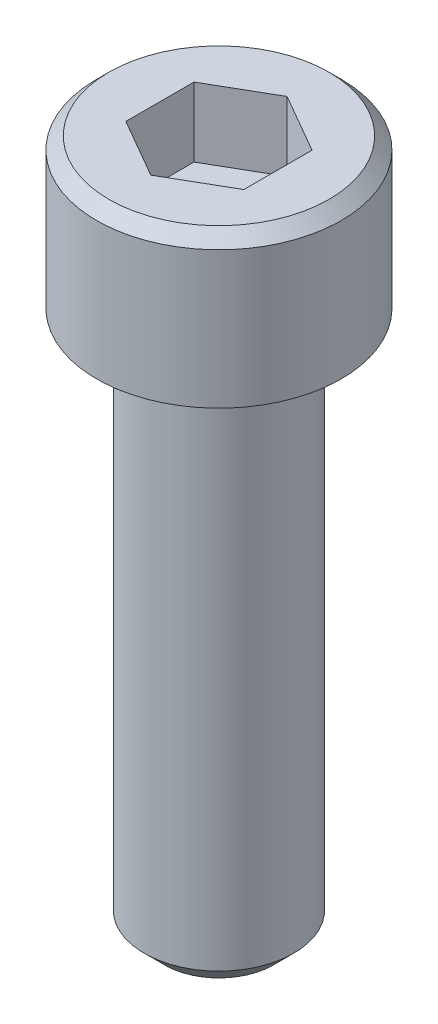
SolidWorks part; units mm, degrees
ref_plane "Front" through (0, 0, 0) normal (0, 0, 1) x (1, 0, 0)
ref_plane "Top" through (0, 0, 0) normal (0, 1, 0) x (1, 0, 0)
ref_plane "Right" through (0, 0, 0) normal (1, 0, 0) x (0, 0, -1)
sketch "Sketch1" plane through (0, 0, 0) normal (0, 0, 1) x (1, 0, 0)
  line L0 (0, 0) -> (2.8702, 0)
  line L1 (2.8702, 0) -> (2.8702, 3.2182)
  line L2 (2.8702, 3.2182) -> (2.5832, 3.5052)
  line L3 (2.5832, 3.5052) -> (0, 3.5052)
  line L4 (0, 3.5052) -> (0, 0)
  line L5 (0, 0) -> (0, 100) construction
revolve "Base-Revolve" add sketch "Sketch1" angle 360 about L5
sketch "Sketch2" plane through (0, 0, 0) normal (0, 0, 1) x (1, 0, 0)
  line L0 (0, 0) -> (0, 100) construction
  line L1 (0, -12.7) -> (1.2802, -12.7)
  line L2 (1.2802, -12.7) -> (1.7526, -12.2276)
  line L3 (1.7526, -12.2276) -> (1.7526, 0)
  line L4 (1.7526, 0) -> (0, 0)
  line L5 (0, 0) -> (0, -12.7)
revolve "Boss-Revolve1" add sketch "Sketch2" angle 360 about L0
ref_plane "Plane4" through (0, 3.5052, 0) normal (0, 1, 0) x (-1, 0, 0)
sketch "Sketch3" plane through (0, 3.5052, 0) normal (0, 1, 0) x (-1, 0, 0)
  line L0 (1.3843, 0.7992) -> (0, 1.5985)
  line L1 (0, 1.5985) -> (-1.3843, 0.7992)
  line L2 (-1.3843, 0.7992) -> (-1.3843, -0.7992)
  line L3 (-1.3843, -0.7992) -> (0, -1.5985)
  line L4 (0, -1.5985) -> (1.3843, -0.7992)
  line L5 (1.3843, -0.7992) -> (1.3843, 0.7992)
extrude "Cut-Extrude1" cut sketch "Sketch3" against normal blind 1.6256
